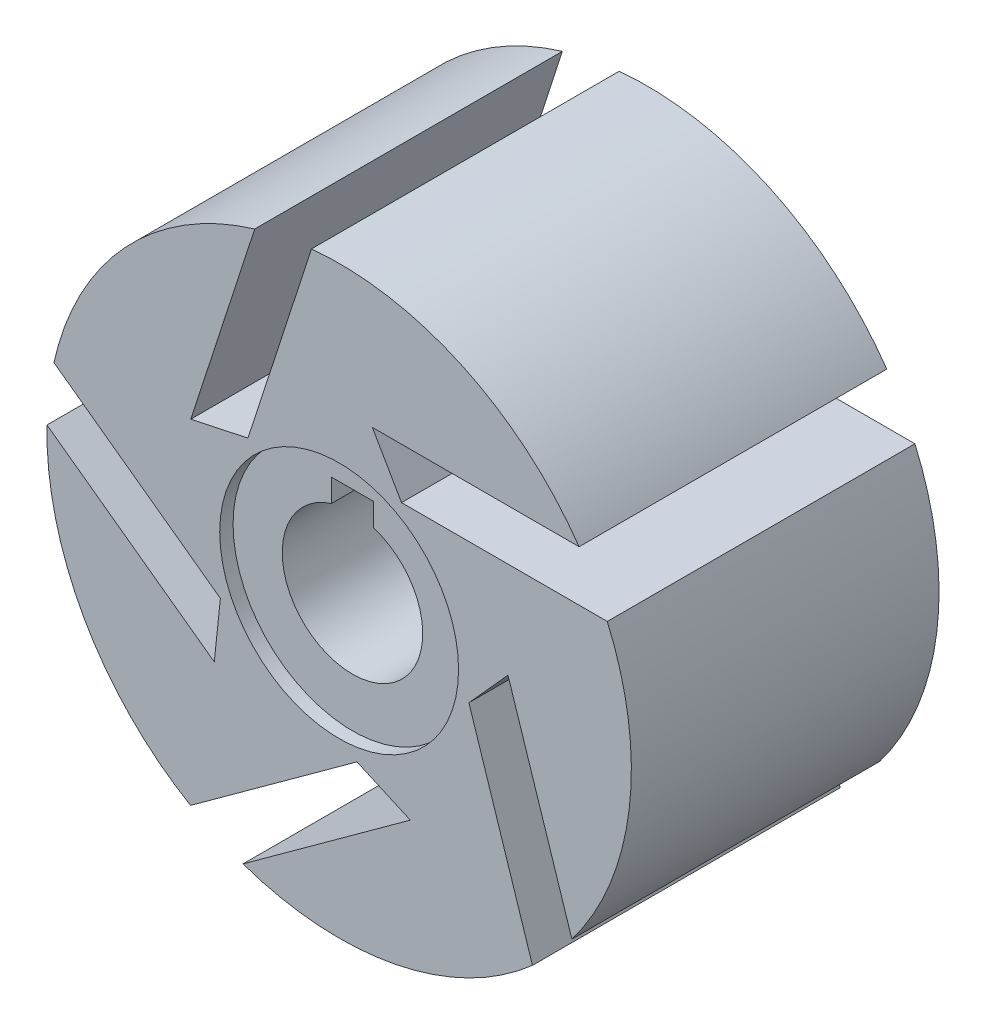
SolidWorks part; units mm, degrees
ref_plane "Plan de face" through (0, 0, 0) normal (0, 0, 1) x (1, 0, 0)
ref_plane "Plan de dessus" through (0, 0, 0) normal (0, 1, 0) x (1, 0, 0)
ref_plane "Plan de droite" through (0, 0, 0) normal (1, 0, 0) x (0, 0, -1)
sketch "Esquisse1" plane through (21.9, 0, 0) normal (0, 0, -1) x (-1, 0, 0)
  circle A0 centre (21.9, 0) radius 20.8
  dimension "D1" = 41.6
extrude "Boss.-Extru.1" add sketch "Esquisse1" against normal blind 21.9 separate body
sketch "Esquisse2" plane through (0, 0, 0) normal (0, 0, -1) x (-1, 0, 0)
  line L0 (-17.0813, 11.8688) -> (-2.3623, 11.8688)
  line L2 (-2.3623, 11.8688) -> (-4.4408, 8.2688)
  line L7 (-4.4408, 8.2688) -> (-19.0858, 8.2688)
  circle A0 centre (0, 0) radius 20.8 construction
  arc A1 (-17.0813, 11.8688) -> (-19.0858, 8.2688) centre (0, 0) ccw
  dimension "D7" = 3.6
  dimension "D8" = 14.719
  dimension "D9" = 14.645
  dimension "D10" = 60
extrude "Enlèv. mat.-Extru.1" cut sketch "Esquisse2" against normal through all
pattern_circular "Répétition circulaire1" count 5 every 72 about axis through (0, 0, 0) along (0, 0, 1) of "Enlèv. mat.-Extru.1"
sketch "Esquisse3" plane through (0, 0, 0) normal (0, 0, -1) x (-1, 0, 0)
  circle A0 centre (0, 0) radius 5
  dimension "D1" = 10
extrude "Enlèv. mat.-Extru.2" cut sketch "Esquisse3" against normal through all
sketch "Esquisse4" plane through (0, 0, 0) normal (0, 0, -1) x (-1, 0, 0)
  line L1 (-1.5, 6.4) -> (1.5, 6.4)
  line L2 (-1.5, 6.4) -> (-1.5, 3.4)
  line L3 (-1.5, 3.4) -> (1.5, 3.4)
  line L4 (1.5, 6.4) -> (1.5, 3.4)
  dimension "D1" = 6.4
  dimension "D2" = 3
  dimension "D3" = 1.5
  dimension "D4" = 3
extrude "Enlèv. mat.-Extru.3" cut sketch "Esquisse4" against normal through all
sketch "Esquisse5" plane through (0, 0, 0) normal (0, 0, -1) x (-1, 0, 0)
  circle A0 centre (0, 0) radius 8.5
  dimension "D1" = 17
extrude "Enlèv. mat.-Extru.4" cut sketch "Esquisse5" against normal blind 0.95
sketch "Esquisse6" plane through (0, 0, 21.9) normal (0, 0, 1) x (1, 0, 0)
  circle A0 centre (0, 0) radius 8.5
  dimension "D1" = 17
extrude "Enlèv. mat.-Extru.5" cut sketch "Esquisse6" against normal blind 0.95
